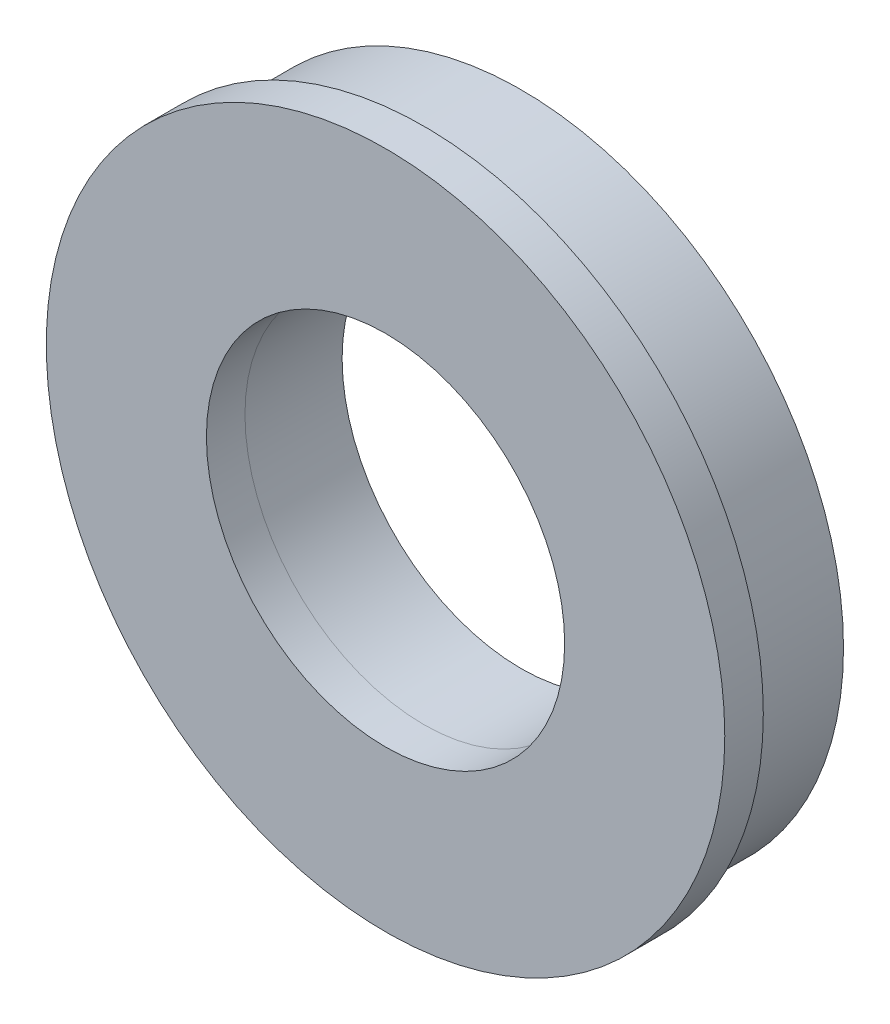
SolidWorks part; units mm, degrees
ref_plane "Front Plane" through (0, 0, 0) normal (0, 0, 1) x (1, 0, 0)
ref_plane "Top Plane" through (0, 0, 0) normal (0, 1, 0) x (1, 0, 0)
ref_plane "Right Plane" through (0, 0, 0) normal (1, 0, 0) x (0, 0, -1)
sketch "Sketch1" plane through (0, 0, 0) normal (0, 0, 1) x (1, 0, 0)
  circle A0 centre (0, 0) radius 4.191
  circle A1 centre (0, 0) radius 7.9375
  dimension "ID" = 8.382
  dimension "OD" = 15.875
extrude "Extrude1" add sketch "Sketch1" against normal blind 0.9017
sketch "Sketch2" plane through (0, 0, -0.9017) normal (0, 0, -1) x (-1, 0, 0)
  circle A0 centre (0, 0) radius 4.191 construction
  circle A1 centre (0, 0) radius 4.191
  circle A2 centre (0, 0) radius 7.5406
  dimension "D1" = 15.0812
extrude "Extrude2" add sketch "Sketch2" along normal offset from surface (2.2733 mm away) 3.175 separate body
equation "\"D1@Sketch2\" = \"OD@Sketch1\"*.95"
